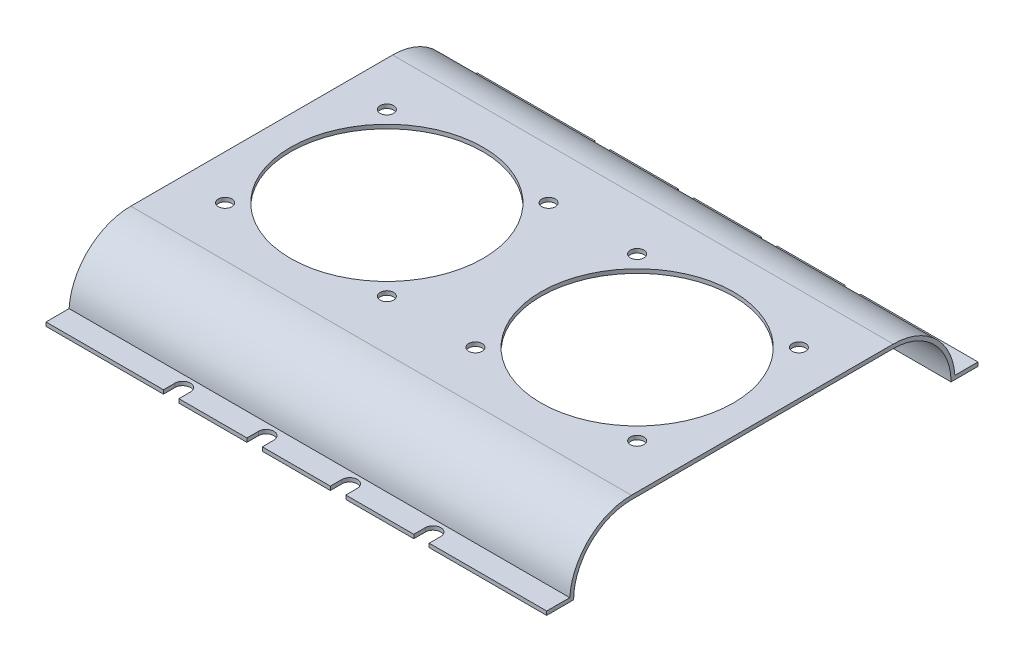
SolidWorks part; units mm, degrees
ref_plane "Ebene vorne" through (0, 0, 0) normal (0, 0, 1) x (1, 0, 0)
ref_plane "Ebene oben" through (0, 0, 0) normal (0, 1, 0) x (1, 0, 0)
ref_plane "Ebene rechts" through (0, 0, 0) normal (1, 0, 0) x (0, 0, -1)
sketch "Skizze4" plane through (0, 0, 0) normal (1, 0, 0) x (0, 0, -1)
  line L0 (33.9997, 0) -> (26.9997, 0)
  line L1 (11.9997, 15) -> (-56.0003, 15)
  line L2 (-71.0003, 0) -> (-78.0003, 0)
  line L3 (-56.0003, 16.0312) -> (11.9997, 16.0312)
  line L4 (-78.0003, 0) -> (-78.0003, 1)
  line L5 (-78.0003, 1) -> (-72.0003, 1)
  line L6 (33.9997, 0) -> (33.9997, 1)
  line L7 (33.9997, 1) -> (27.9997, 1)
  arc A0 (11.9997, 15) -> (26.9997, 0) centre (11.9997, 0) cw
  arc A1 (-56.0003, 15) -> (-71.0003, 0) centre (-56.0003, 0) ccw
  arc A2 (-72.0003, 1) -> (-56.0003, 16.0312) centre (-56.0003, 0) cw
  arc A3 (27.9997, 1) -> (11.9997, 16.0312) centre (11.9997, 0) ccw
  dimension "D1" = 7
  dimension "D2" = 15
  dimension "D3" = 15
  dimension "D4" = 68
  dimension "D5" = 15
  dimension "D6" = 7
  dimension "D7" = 1
  dimension "D8" = 1
  dimension "D9" = 6
  dimension "D10" = 6
sketch3d "3D-Skizze4"
  line L0 (0, 1, 72.0003) -> (0, 0, 72.0003)
  line L1 (0, 0, 71.0003) -> (0, 0, 78.0003) construction
  line L2 (0, 0, 72.0003) -> (0, 0, 78.0003)
  line L3 (0, 0, 78.0003) -> (0, 1, 78.0003)
  line L4 (0, 1, 78.0003) -> (0, 1, 72.0003)
sketch3d "3D-Skizze5"
  line L0 (0, 0, 78.0003) -> (15.7164, 0, 78.0003)
extrude "Aufsatz-Linear austragen7" add sketch "3D-Skizze4" along direction (1, 0, 0) on the side of the normal blind 130
sketch3d "3D-Skizze6"
  line L0 (0, 0, 71.0003) -> (0, 0, 78.0003) construction
  line L1 (0, 0, 72.0315) -> (0, 0, 71.0003)
  line L2 (0, 15, 56.0003) -> (0, 16.0312, 56.0003)
  arc A0 (0, 15, 56.0003) -> (0, 0, 71.0003) centre (0, 0, 56.0003) ccw
  arc A1 (0, 15, 56.0003) -> (0, 0, 71.0003) centre (0, 0, 56.0003) ccw construction
  arc A2 (0, 16.0312, 56.0003) -> (0, 0, 72.0315) centre (0, 0, 56.0003) ccw
  point P2 (15, 0, 56.0003)
  point P9 (15, 0, 56.0003)
  point P11 (16.0312, 0, 56.0003)
extrude "Aufsatz-Linear austragen8" add sketch "3D-Skizze6" along a picked direction on the side against the normal blind 130
sketch3d "3D-Skizze7"
  line L1 (0, 16.0312, -11.9997) -> (0, 15, -11.9997)
  line L2 (0, 16.0312, -11.9997) -> (0, 16.0312, 56.0003)
  line L3 (0, 16.0312, 56.0003) -> (0, 15, 56.0003)
  line L4 (0, 15, -11.9997) -> (0, 15, 56.0003)
extrude "Aufsatz-Linear austragen9" add sketch "3D-Skizze7" along a picked direction on the side of the normal blind 130
sketch3d "3D-Skizze8"
  line L0 (0, 0, -33.9997) -> (0, 0, -26.9997) construction
  line L1 (0, 0, -28.031) -> (0, 0.0099, -26.9997)
  line L2 (0, 16.0312, -11.9997) -> (0, 15, -11.9997)
  arc A0 (0, 15, -11.9997) -> (0, 0.0099, -26.9997) centre (0, 0, -11.9997) cw
  arc A1 (0, 16.0312, -11.9997) -> (0, 0, -28.031) centre (0, 0, -11.9997) cw
  point P2 (-15, 0, -11.9997)
  point P7 (-16.0312, 0, -11.9997)
extrude "Aufsatz-Linear austragen10" add sketch "3D-Skizze8" along a picked direction on the side of the normal blind 130
sketch3d "3D-Skizze9"
  line L1 (0, 1, -27.9997) -> (0, 0, -27.9997)
  line L2 (0, 1, -27.9997) -> (0, 1, -33.9997)
  line L3 (0, 1, -33.9997) -> (0, 0, -33.9997)
  line L4 (0, 0, -27.9997) -> (0, 0, -33.9997)
extrude "Aufsatz-Linear austragen11" add sketch "3D-Skizze9" along a picked direction on the side against the normal blind 130
sketch "Skizze5" plane through (0, 16.0312, 0) normal (0, 1, 0) x (1, 0, 0)
  circle A0 centre (97.5, -22.0003) radius 25
  circle A1 centre (32.5, -22.0003) radius 25
extrude "Schnitt-Linear austragen1" cut sketch "Skizze5" against normal blind 12
sketch "Skizze6" plane through (0, 1, 0) normal (0, 1, 0) x (1, 0, 0)
  line L1 (73.834, -75.0003) -> (73.834, -78.0003)
  line L2 (73.834, -78.0003) -> (77.834, -78.0003)
  line L4 (52.168, -75.0003) -> (52.168, -78.0003)
  line L5 (52.168, -78.0003) -> (56.168, -78.0003)
  line L6 (56.168, -78.0003) -> (56.168, -75.0003)
  line L7 (77.834, -78.0003) -> (77.834, -75.0003)
  line L8 (34.5, -75.0003) -> (34.5, -78.0003)
  line L9 (0, -78.0003) -> (130, -78.0003) construction
  line L10 (30.5, -75.0003) -> (30.5, -78.0003)
  line L11 (30.5, -78.0003) -> (34.5, -78.0003)
  line L12 (95.5, -75.0003) -> (95.5, -78.0003)
  line L13 (95.5, -78.0003) -> (99.5, -78.0003)
  line L14 (99.5, -78.0003) -> (99.5, -75.0003)
  arc A0 (30.5, -75.0003) -> (34.5, -75.0003) centre (32.5, -75.0003) cw
  arc A1 (52.168, -75.0003) -> (56.168, -75.0003) centre (54.168, -75.0003) cw
  arc A2 (73.834, -75.0003) -> (77.834, -75.0003) centre (75.834, -75.0003) cw
  arc A3 (95.5, -75.0003) -> (99.5, -75.0003) centre (97.5, -75.0003) cw
extrude "Schnitt-Linear austragen2" cut sketch "Skizze6" against normal blind 2
sketch "Skizze8" plane through (0, 1, 0) normal (0, 1, 0) x (1, 0, 0)
  line L0 (99.5, 30.9997) -> (99.5, 33.9997)
  line L3 (0, 33.9997) -> (130, 33.9997) construction
  line L4 (95.5, 30.9997) -> (95.5, 33.9997)
  line L8 (95.5, 33.9997) -> (99.5, 33.9997)
  line L9 (77.834, 30.9997) -> (77.834, 33.9997)
  line L10 (73.834, 30.9997) -> (73.834, 33.9997)
  line L11 (73.834, 33.9997) -> (77.834, 33.9997)
  line L12 (56.168, 30.9997) -> (56.168, 33.9997)
  line L13 (52.168, 30.9997) -> (52.168, 33.9997)
  line L14 (52.168, 33.9997) -> (56.168, 33.9997)
  line L15 (34.5, 30.9997) -> (34.5, 33.9997)
  line L16 (30.5, 30.9997) -> (30.5, 33.9997)
  line L17 (30.5, 33.9997) -> (34.5, 33.9997)
  arc A1 (99.5, 30.9997) -> (95.5, 30.9997) centre (97.5, 30.9997) cw
  arc A2 (77.834, 30.9997) -> (73.834, 30.9997) centre (75.834, 30.9997) cw
  arc A3 (56.168, 30.9997) -> (52.168, 30.9997) centre (54.168, 30.9997) cw
  arc A4 (34.5, 30.9997) -> (30.5, 30.9997) centre (32.5, 30.9997) cw
extrude "Schnitt-Linear austragen4" cut sketch "Skizze8" against normal blind 2
sketch "Skizze9" plane through (0, 16.0312, 0) normal (0, 1, 0) x (1, 0, 0)
  circle A2 centre (11.4989, -0.9992) radius 1.75
  circle A3 centre (53.5011, -0.9992) radius 1.75
  circle A4 centre (76.4989, -0.9992) radius 1.75
  circle A5 centre (118.5011, -0.9992) radius 1.75
  circle A6 centre (118.5011, -43.0013) radius 1.75
  circle A7 centre (76.4989, -43.0013) radius 1.75
  circle A8 centre (53.5011, -43.0013) radius 1.75
  circle A9 centre (11.4989, -43.0013) radius 1.75
extrude "Schnitt-Linear austragen10" cut sketch "Skizze9" against normal blind 2
